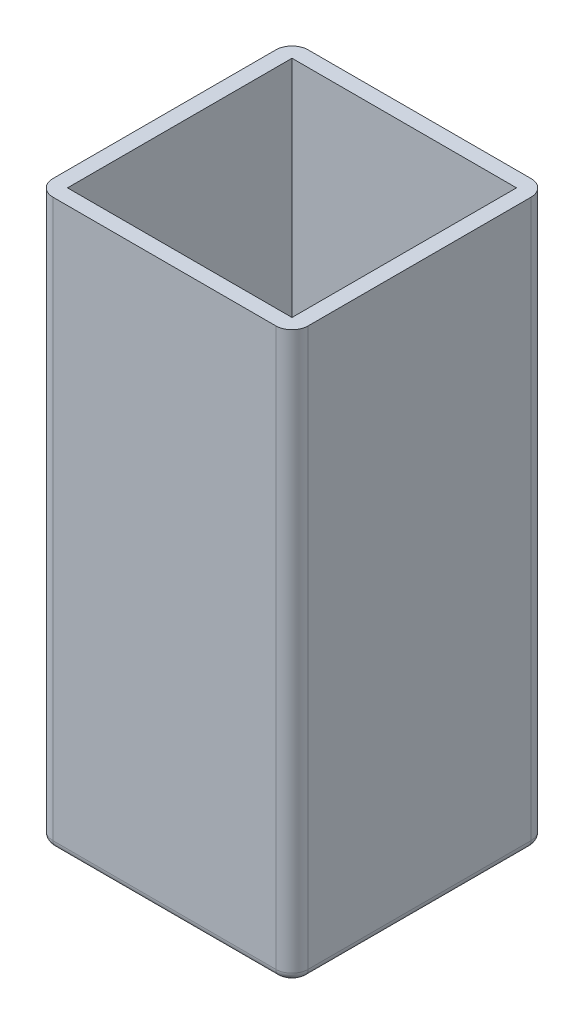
SolidWorks part; units mm, degrees
ref_plane "Front Plane" through (0, 0, 0) normal (0, 0, 1) x (1, 0, 0)
ref_plane "Top Plane" through (0, 0, 0) normal (0, 1, 0) x (1, 0, 0)
ref_plane "Right Plane" through (0, 0, 0) normal (1, 0, 0) x (0, 0, -1)
sketch "Sketch1" plane through (0, 0, 0) normal (0, 1, 0) x (1, 0, 0)
  line L0 (-6.95, 6.95) -> (-6.95, -6.95)
  line L1 (-7.9, 7.9) -> (7.9, 7.9)
  line L2 (-7.9, 7.9) -> (-7.9, -7.9)
  line L3 (-7.9, -7.9) -> (7.9, -7.9)
  line L4 (7.9, 7.9) -> (7.9, -7.9)
  line L5 (-7.9, 7.9) -> (7.9, -7.9) construction
  line L6 (-7.9, -7.9) -> (7.9, 7.9) construction
  line L7 (-6.95, -6.95) -> (6.95, -6.95)
  line L8 (6.95, 6.95) -> (6.95, -6.95)
  line L9 (-6.95, 6.95) -> (6.95, 6.95)
  point P0 (0, 0)
  dimension "D1" = 15.8
  dimension "D2" = 15.8
  dimension "D3" = 0.95
extrude "Boss-Extrude1" add sketch "Sketch1" along normal blind 34
sketch "Sketch2" plane through (0, 0, 0) normal (0, -1, 0) x (1, 0, 0)
  line L4 (7.9, -7.9) -> (7.9, 7.9)
  line L5 (7.9, 7.9) -> (-7.9, 7.9)
  line L6 (-7.9, 7.9) -> (-7.9, -7.9)
  line L7 (-7.9, -7.9) -> (7.9, -7.9)
  line L8 (7.9, -7.9) -> (7.9, 7.9)
  line L9 (7.9, 7.9) -> (-7.9, 7.9)
  line L10 (-7.9, 7.9) -> (-7.9, -7.9)
  line L11 (-7.9, -7.9) -> (7.9, -7.9)
  dimension "D1" = 0
extrude "Boss-Extrude2" add sketch "Sketch2" along normal blind 1
fillet "Fillet1" radius 1 4 edges at (-7.9, 16.5, -7.9) (7.9, 16.5, -7.9) (-7.9, 16.5, 7.9) (7.9, 16.5, 7.9)
fillet "Fillet2" radius 0.5 8 edges at (7.6071, -1, 7.6071) (7.9, -1, 0) (7.6071, -1, -7.6071) (0, -1, -7.9) (-7.6071, -1, -7.6071) (-7.9, -1, 0) (-7.6071, -1, 7.6071) (0, -1, 7.9)
